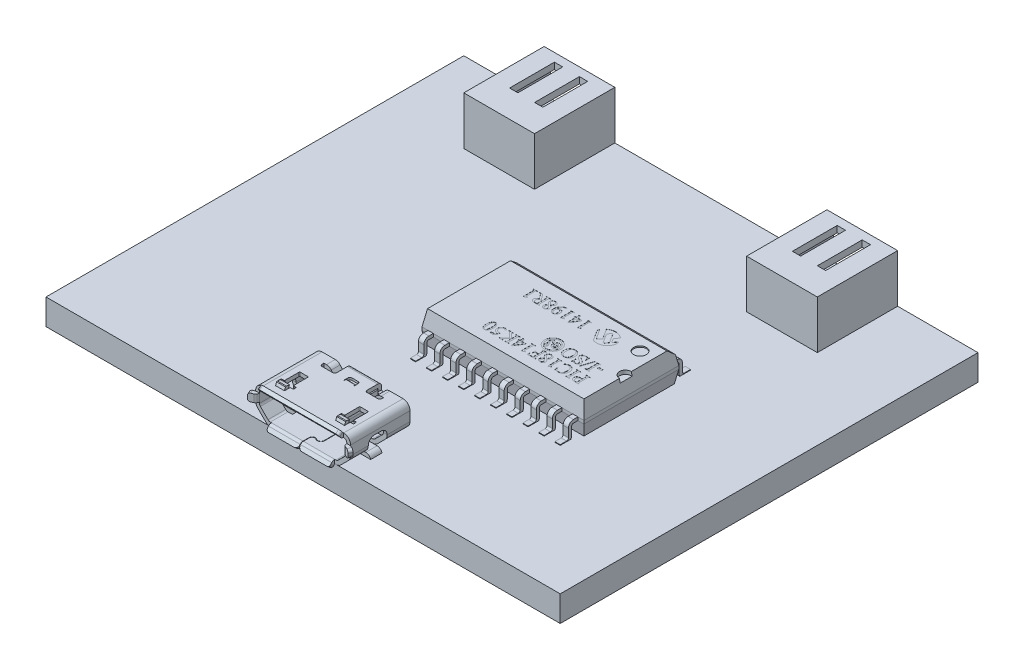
SolidWorks part; units mm, degrees
other "<Chip-PIC18F14K50>-<Imported1>"
other "<USB Socket-Micro>-<Imported1>"
ref_plane "Front Plane" through (0, 0, 0) normal (0, 0, 1) x (1, 0, 0)
ref_plane "Top Plane" through (0, 0, 0) normal (0, 1, 0) x (1, 0, 0)
ref_plane "Right Plane" through (0, 0, 0) normal (1, 0, 0) x (0, 0, -1)
sketch "Sketch1" plane through (0, 0, 0) normal (0, 1, 0) x (1, 0, 0)
  line L1 (-20.32, -16.51) -> (20.32, -16.51)
  line L2 (-20.32, -16.51) -> (-20.32, 16.51)
  line L3 (-20.32, 16.51) -> (20.32, 16.51)
  line L4 (20.32, -16.51) -> (20.32, 16.51)
  line L5 (-20.32, -16.51) -> (20.32, 16.51) construction
  line L6 (-20.32, 16.51) -> (20.32, -16.51) construction
  point P0 (0, 0)
  dimension "D1" = 40.64
  dimension "D2" = 33.02
extrude "Boss-Extrude1" add sketch "Sketch1" along normal blind 2.032
ref_plane "Front Plane-USB Socket-Micro" through (0, 3.257, 14.16) normal (0, 0, 1) x (1, 0, 0)
ref_plane "Top Plane-USB Socket-Micro" through (0, 3.257, 14.16) normal (0, 1, 0) x (1, 0, 0)
ref_plane "Right Plane-USB Socket-Micro" through (0, 3.257, 14.16) normal (1, 0, 0) x (0, 0, -1)
inserted part "USB Socket-Micro"
move or copy body "Body-Move/Copy2"
ref_plane "Front Plane-Chip-PIC18F14K50" through (4.235, 1.832, 1.2) normal (0, 1, 0) x (0, 0, 1)
ref_plane "Top Plane-Chip-PIC18F14K50" through (4.235, 1.832, 1.2) normal (1, 0, 0) x (0, 0, 1)
ref_plane "Right Plane-Chip-PIC18F14K50" through (4.235, 1.832, 1.2) normal (0, 0, 1) x (0, -1, 0)
inserted part "Chip-PIC18F14K50"
move or copy body "Body-Move/Copy4"
other "Distance1" parameters "D1"=10.16
other "Distance2" parameters "D1"=10.16
sketch "Sketch2" plane through (0, 2.032, 0) normal (0, 1, 0) x (1, 0, 0)
  line L0 (20.32, 16.51) -> (-20.32, 16.51) construction
  line L1 (-13.97, 16.51) -> (-8.382, 16.51)
  line L2 (-13.97, 16.51) -> (-13.97, 10.16)
  line L3 (-13.97, 10.16) -> (-8.382, 10.16)
  line L4 (-8.382, 16.51) -> (-8.382, 10.16)
  line L5 (-20.32, 16.51) -> (-20.32, -16.51) construction
  line L6 (8.382, 16.51) -> (13.97, 16.51)
  line L7 (8.382, 16.51) -> (8.382, 10.16)
  line L8 (8.382, 10.16) -> (13.97, 10.16)
  line L9 (13.97, 16.51) -> (13.97, 10.16)
  line L10 (20.32, -16.51) -> (20.32, 16.51) construction
  dimension "D1" = 6.35
  dimension "D2" = 6.35
  dimension "D3" = 5.588
  dimension "D4" = 6.35
extrude "Boss-Extrude2" add sketch "Sketch2" along normal blind 3.81 separate body
sketch "Sketch3" plane through (0, 0, -16.51) normal (0, 0, -1) x (-1, 0, 0)
  line L0 (-8.89, 5.334) -> (-13.462, 5.334)
  line L1 (-13.462, 5.334) -> (-13.462, 2.54)
  line L2 (-13.462, 2.54) -> (-8.89, 2.54)
  line L3 (-8.89, 2.54) -> (-8.89, 5.334)
  line L4 (-13.97, 2.032) -> (-8.382, 2.032)
  line L5 (-8.382, 2.032) -> (-8.382, 5.842)
  line L6 (-8.382, 5.842) -> (-13.97, 5.842)
  line L7 (-13.97, 5.842) -> (-13.97, 2.032)
  line L8 (-13.97, 2.032) -> (-8.382, 2.032)
  line L9 (-8.382, 2.032) -> (-8.382, 5.842)
  line L10 (-8.382, 5.842) -> (-13.97, 5.842)
  line L11 (-13.97, 5.842) -> (-13.97, 2.032)
  line L12 (8.382, 2.032) -> (13.97, 2.032)
  line L13 (13.97, 2.032) -> (13.97, 5.842)
  line L14 (13.97, 5.842) -> (8.382, 5.842)
  line L15 (8.382, 5.842) -> (8.382, 2.032)
  line L16 (8.382, 2.032) -> (13.97, 2.032)
  line L17 (13.97, 2.032) -> (13.97, 5.842)
  line L18 (13.97, 5.842) -> (8.382, 5.842)
  line L19 (8.382, 5.842) -> (8.382, 2.032)
  line L20 (13.462, 5.334) -> (8.89, 5.334)
  line L21 (8.89, 5.334) -> (8.89, 2.54)
  line L22 (8.89, 2.54) -> (13.462, 2.54)
  line L23 (13.462, 2.54) -> (13.462, 5.334)
  dimension "D1" = 0
  dimension "D2" = 0
  dimension "D3" = 0.508
  dimension "D4" = 0.508
extrude "Cut-Extrude1" cut sketch "Sketch3" against normal blind 3.81 contours L2 L3 L0 L1 | L22 L23 L20 L21
sketch "Sketch4" plane through (0, 5.842, 0) normal (0, 1, 0) x (1, 0, 0)
  line L0 (12.4922, 15.8423) -> (13.97, 15.8423) construction
  line L1 (12.4922, 15.8423) -> (11.8363, 15.8423)
  line L2 (12.4922, 15.8423) -> (12.4922, 12.3005)
  line L3 (12.4922, 12.3005) -> (11.8363, 12.3005)
  line L4 (11.8363, 15.8423) -> (11.8363, 12.3005)
  line L5 (10.5157, 15.8423) -> (9.8598, 15.8423)
  line L6 (10.5157, 15.8423) -> (10.5157, 12.3005)
  line L7 (10.5157, 12.3005) -> (9.8598, 12.3005)
  line L8 (9.8598, 15.8423) -> (9.8598, 12.3005)
  line L9 (-9.8598, 15.8423) -> (-10.5157, 15.8423)
  line L10 (-9.8598, 15.8423) -> (-9.8598, 12.3005)
  line L11 (-9.8598, 12.3005) -> (-10.5157, 12.3005)
  line L12 (-10.5157, 15.8423) -> (-10.5157, 12.3005)
  line L13 (-11.8363, 15.8423) -> (-12.4922, 15.8423)
  line L14 (-11.8363, 15.8423) -> (-11.8363, 12.3005)
  line L15 (-11.8363, 12.3005) -> (-12.4922, 12.3005)
  line L16 (-12.4922, 15.8423) -> (-12.4922, 12.3005)
  line L17 (13.97, 10.16) -> (13.97, 16.51) construction
  line L18 (9.8598, 15.8423) -> (8.382, 15.8423) construction
  line L19 (8.382, 16.51) -> (8.382, 10.16) construction
  line L20 (10.5157, 15.8423) -> (11.8363, 15.8423) construction
  line L21 (-9.8598, 15.8423) -> (-8.382, 15.8423) construction
  line L22 (-10.5157, 15.8423) -> (-11.8363, 15.8423) construction
  line L23 (-12.4922, 15.8423) -> (-13.97, 15.8423) construction
  line L24 (-13.97, 16.51) -> (-13.97, 10.16) construction
  line L25 (-8.382, 10.16) -> (-8.382, 16.51) construction
  line L26 (-8.382, 15.8423) -> (8.382, 15.8423) construction
extrude "Cut-Extrude2" cut sketch "Sketch4" against normal up to surface (0.508 mm away)
